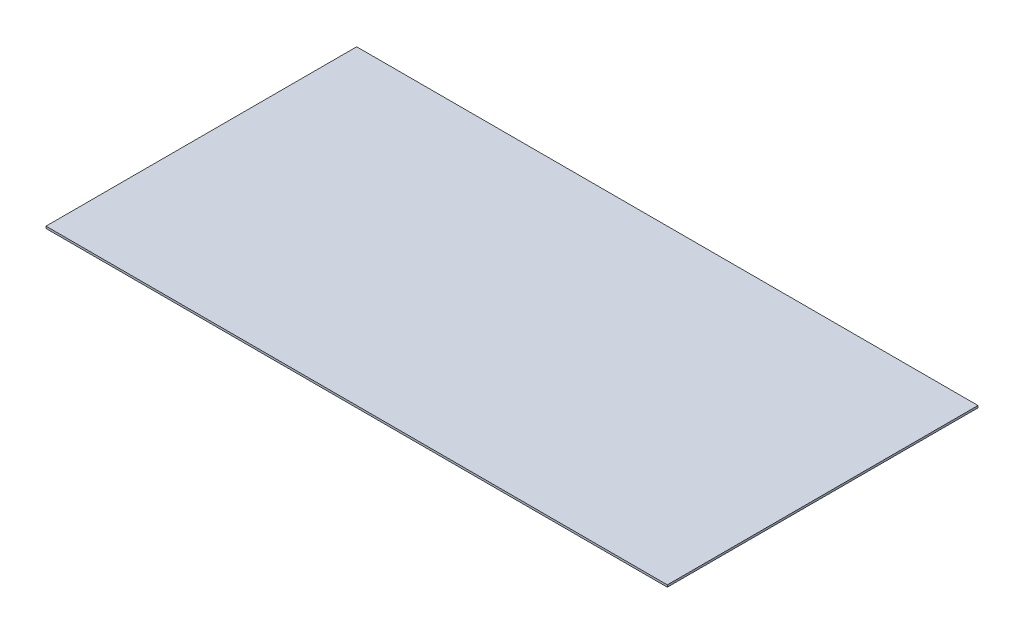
SolidWorks part; units mm, degrees
ref_plane "Front Plane" through (0, 0, 0) normal (0, 0, 1) x (1, 0, 0)
ref_plane "Top Plane" through (0, 0, 0) normal (0, 1, 0) x (1, 0, 0)
ref_plane "Right Plane" through (0, 0, 0) normal (1, 0, 0) x (0, 0, -1)
sketch "Sketch1" plane through (0, 0, 0) normal (0, 1, 0) x (1, 0, 0)
  line L1 (-1500, -750) -> (1500, -750)
  line L2 (-1500, -750) -> (-1500, 750)
  line L3 (-1500, 750) -> (1500, 750)
  line L4 (1500, -750) -> (1500, 750)
  line L5 (-1500, -750) -> (1500, 750) construction
  line L6 (-1500, 750) -> (1500, -750) construction
  point P0 (0, 0)
  dimension "D1" = 1500
  dimension "D2" = 3000
extrude "Boss-Extrude1" add sketch "Sketch1" along normal blind 10
